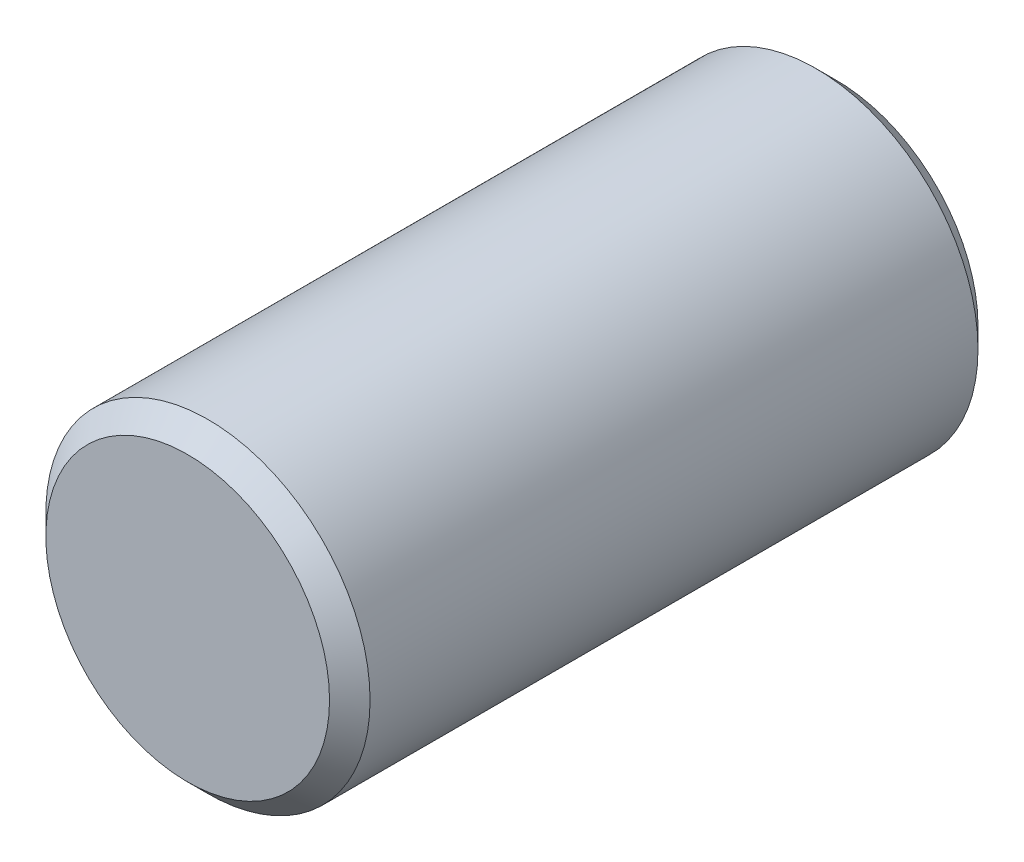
SolidWorks part; units mm, degrees
ref_plane "Front Plane" through (0, 0, 0) normal (0, 0, 1) x (1, 0, 0)
ref_plane "Top Plane" through (0, 0, 0) normal (0, 1, 0) x (1, 0, 0)
ref_plane "Right Plane" through (0, 0, 0) normal (1, 0, 0) x (0, 0, -1)
sketch "Sketch1" plane through (0, 0, 0) normal (1, 0, 0) x (0, 0, -1)
  line L0 (10.6747, 0) -> (50010.6747, 0) construction
  line L1 (0, 0) -> (8, 0)
  line L6 (0.25, 2) -> (0, 1.75)
  line L7 (0, 1.75) -> (0, 0)
  line L8 (7.75, 2) -> (0.25, 2)
  line L9 (8, 1.75) -> (7.75, 2)
  line L10 (8, 0) -> (8, 1.75)
  dimension "D1" = 45
  dimension "D2" = 45
  dimension "D3" = 8
  dimension "D4" = 0.25
  dimension "D5" = 4
revolve "Revolve1" add sketch "Sketch1" angle 360 about L0
